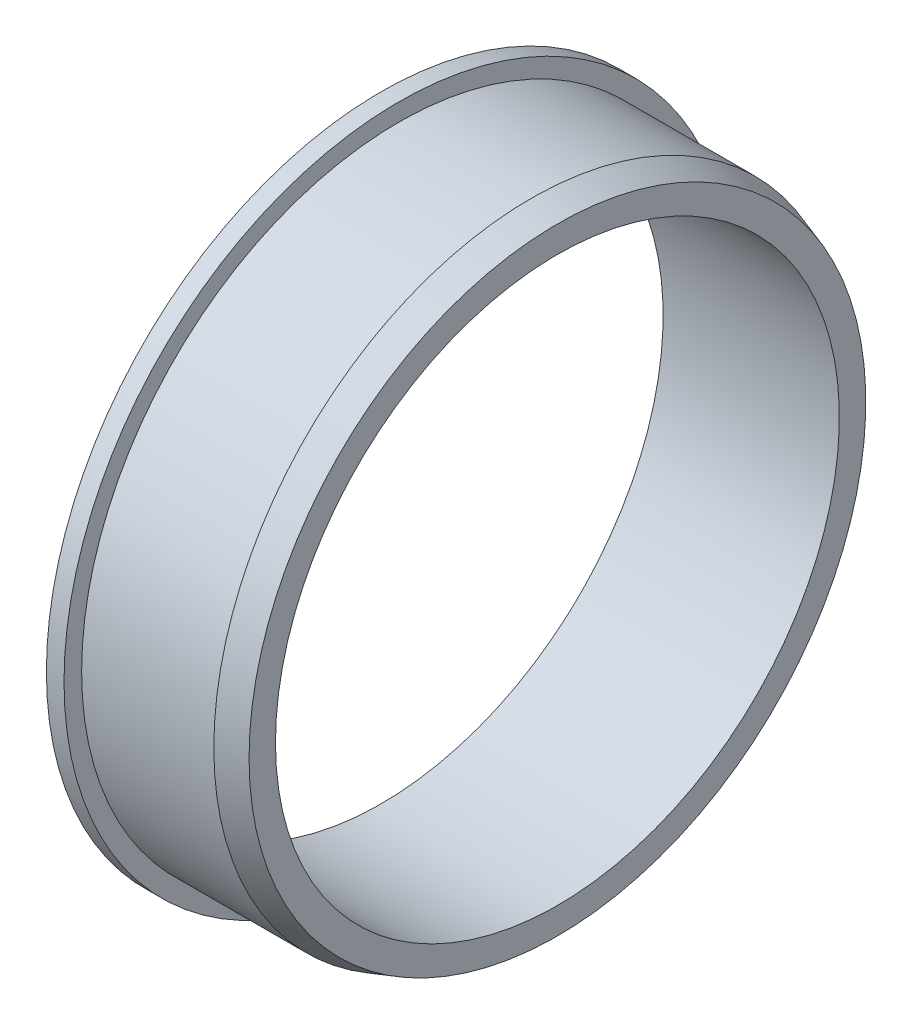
SolidWorks part; units mm, degrees
ref_plane "Plane1" through (0, 0, 0) normal (0, 0, 1) x (1, 0, 0)
ref_plane "Plane2" through (0, 0, 0) normal (0, 1, 0) x (1, 0, 0)
ref_plane "Plane3" through (0, 0, 0) normal (1, 0, 0) x (0, 0, -1)
sketch "Esquisse1" plane through (0, 0, 0) normal (0, 0, 1) x (1, 0, 0)
  line L0 (0, 8) -> (0, 9.5)
  line L1 (0, 9.5) -> (0.5, 9.5)
  line L2 (0.5, 9.5) -> (0.5, 9)
  line L3 (0.5, 9) -> (4.25, 9)
  line L4 (4.25, 9) -> (5, 8.75)
  line L5 (5, 8.75) -> (5, 8)
  line L6 (5, 8) -> (0, 8)
  line L7 (-0.95, 0) -> (6.75, 0) construction
revolve "Base-Révolution" add sketch "Esquisse1" angle 360 about L7
